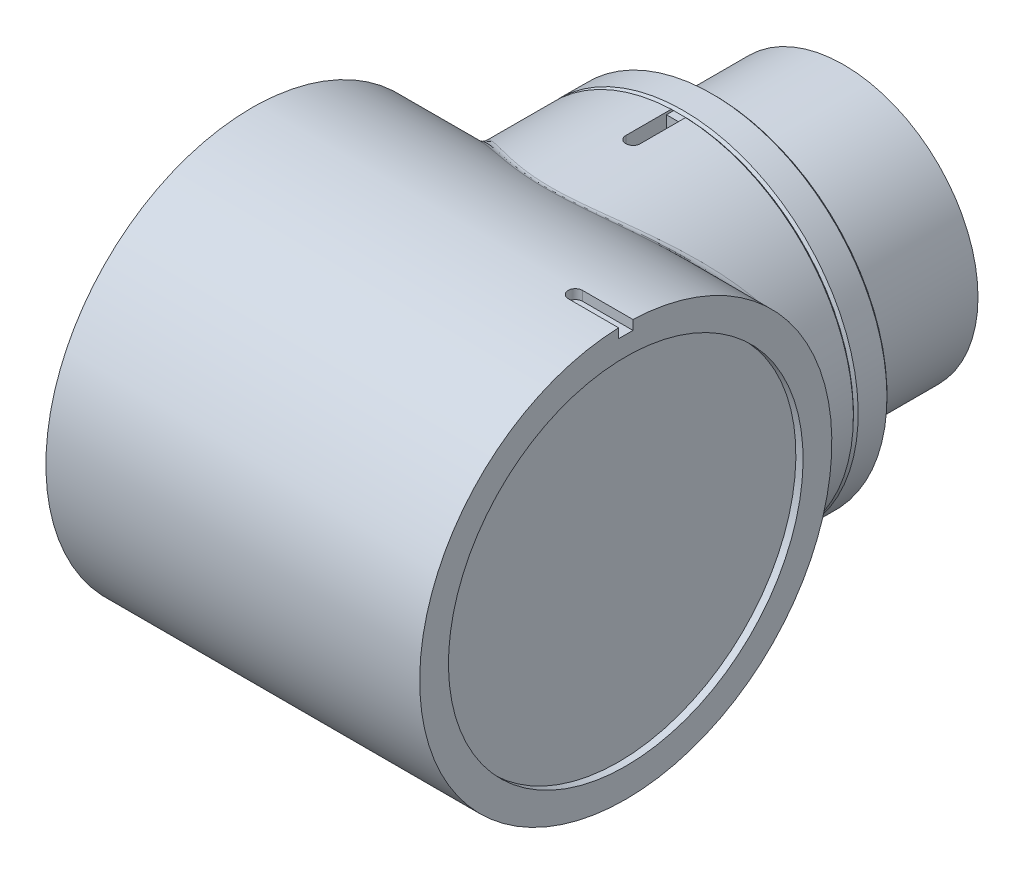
SolidWorks part; units mm, degrees
ref_plane "前视基准面" through (0, 0, 0) normal (0, 0, 1) x (1, 0, 0)
ref_plane "上视基准面" through (0, 0, 0) normal (0, 1, 0) x (1, 0, 0)
ref_plane "右视基准面" through (0, 0, 0) normal (1, 0, 0) x (0, 0, -1)
imported_body "输入1"
imported_body "输入2"
imported_body "输入3"
sketch "草图1" plane through (0, 0, -901) normal (0, 0, -1) x (-1, 0, 0)
  circle A1 centre (0, 1185) radius 21.5
  circle A2 centre (0, 1185) radius 21.5
  dimension "D1" = 0
extrude "切除-拉伸1" cut sketch "草图1" against normal up to surface (10.5 mm away)
